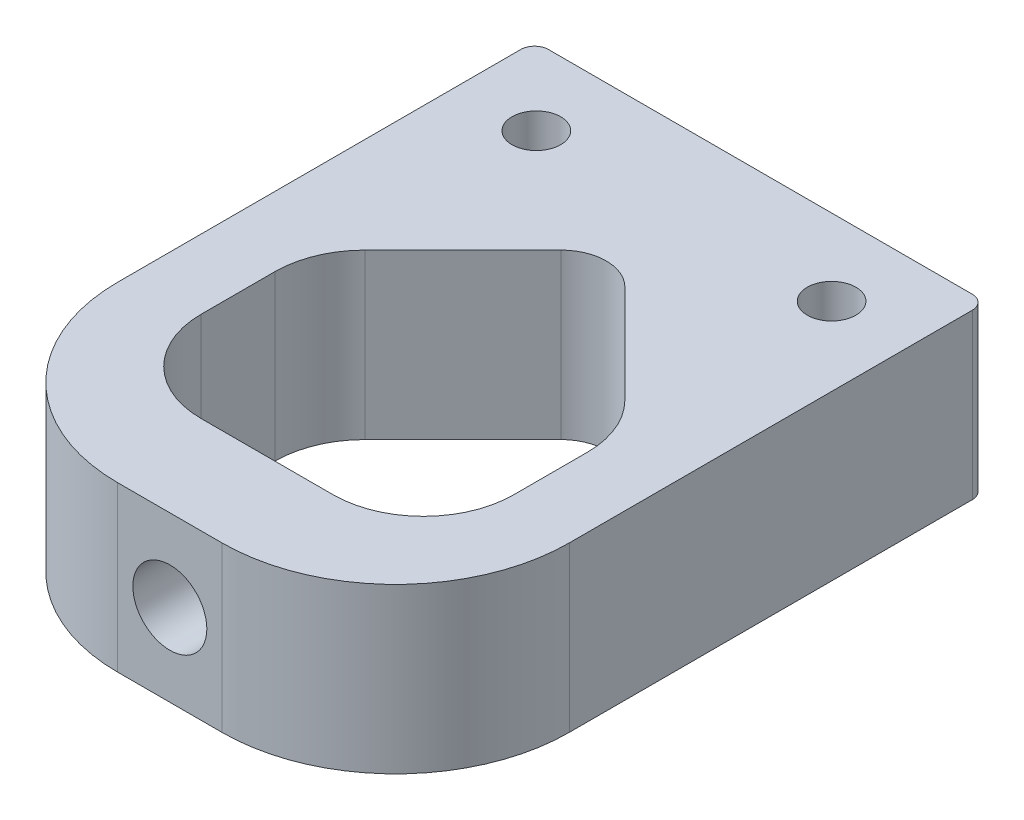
SolidWorks part; units mm, degrees
ref_plane "Front Plane" through (0, 0, 0) normal (0, 0, 1) x (1, 0, 0)
ref_plane "Top Plane" through (0, 0, 0) normal (0, 1, 0) x (1, 0, 0)
ref_plane "Right Plane" through (0, 0, 0) normal (1, 0, 0) x (0, 0, -1)
sketch "Sketch1" plane through (0, 0, 0) normal (0, 1, 0) x (1, 0, 0)
  line L1 (-27.0046, 23.0125) -> (-10.4946, 23.0125)
  line L2 (-27.0046, 23.0125) -> (-27.0046, 1.4225)
  line L3 (-27.0046, 1.4225) -> (-10.4946, 1.4225)
  line L4 (-10.4946, 23.0125) -> (-10.4946, 1.4225)
  dimension "D1" = 16.51
  dimension "D2" = 21.59
extrude "Boss-Extrude1" add sketch "Sketch1" along normal blind 6
sketch "Sketch2" plane through (0, 6, 0) normal (0, 1, 0) x (1, 0, 0)
  line L0 (-10.4946, 23.0125) -> (-27.0046, 23.0125) construction
  line L2 (-10.4946, 1.4225) -> (-10.4946, 23.0125) construction
  circle A0 centre (-24.1471, 20.2185) radius 0.7572
  circle A1 centre (-13.3521, 20.2185) radius 0.7572
  dimension "D1" = 10.795
  dimension "D2" = 2.794
  dimension "D4" = 2.8575
hole_wizard "#2-56 Tapped Hole1" positions "Sketch4" profile "Sketch3" tap size "#2-56" standard "ANSI Inch"
sketch "Sketch4" plane through (0, 6, 0) normal (0, 1, 0) x (1, 0, 0)
  point P0 (-24.1471, 20.2185)
  point P3 (-13.3521, 20.2185)
sketch "Sketch3" plane through (-24.1471, 6, -20.2185) normal (1, 0, 0) x (0, 0, 1)
  line L0 (0, 0) -> (0, 6)
  line L1 (0, 6) -> (0.889, 6)
  line L2 (0.889, 6) -> (0.889, 0)
  line L5 (0.889, 0) -> (0, 0)
  line L11 (0, -6.35) -> (0, 107.95) construction
  dimension "Thru Tap Drill Dia." = 1.778
  dimension "Thru Tap Drill Depth" = 6
sketch "Sketch5" plane through (0, 6, 0) normal (0, 1, 0) x (1, 0, 0)
  line L0 (-18.7496, 23.0125) -> (-18.7496, -5.13) construction
  line L1 (-10.4946, 23.0125) -> (-27.0046, 23.0125) construction
  line L2 (-18.7496, 18.0595) -> (-13.0346, 12.3445)
  line L4 (-24.4646, 12.3445) -> (-18.7496, 18.0595)
  line L5 (-24.4646, 4.9785) -> (-13.0346, 4.9785)
  line L6 (-24.4646, 4.9785) -> (-24.4646, 12.3445)
  line L7 (-18.7496, 4.9785) -> (-18.7496, 1.4225) construction
  line L8 (-27.0046, 23.0125) -> (-27.0046, 1.4225) construction
  line L10 (-13.0346, 4.9785) -> (-13.0346, 12.3445)
  line L13 (-27.0046, 18.0595) -> (-11.7646, 18.0595) construction
  line L14 (-27.0046, 1.4225) -> (-10.4946, 1.4225) construction
  circle A0 centre (-18.7496, 10.4395) radius 5.461 construction
  circle A1 centre (-18.7496, 11.0745) radius 4.7625 construction
  circle A2 centre (-18.7496, 16.1545) radius 1.651 construction
  dimension "D1" = 11.938
  dimension "D2" = 10.922
  dimension "D3" = 9.525
  dimension "D4" = 8.255
  dimension "D8" = 4.953
  dimension "D10" = 45
  dimension "D9" = 21.59
  dimension "D12" = 11.43
  dimension "D5" = 6.858
  dimension "D6" = 12.573
  dimension "D7" = 3.556
  dimension "D11" = 45
  dimension "D13" = 5.715
  dimension "D14" = 18.034
extrude "Cut-Extrude3" cut sketch "Sketch5" against normal through all
fillet "Fillet3" radius 0.508 2 edges at (-27.0046, 3, -23.0125) (-10.4946, 3, -23.0125)
fillet "Fillet1" radius 6.35 2 edges at (-27.0046, 3, -1.4225) (-10.4946, 3, -1.4225)
fillet "Fillet4" radius 3.302 4 edges at (-13.0346, 3, -4.9785) (-24.4646, 3, -4.9785) (-13.0346, 3, -12.3445) (-24.4646, 3, -12.3445)
fillet "Fillet5" radius 1.651 1 edges at (-18.7496, 3, -18.0595)
sketch "Sketch7" plane through (0, 0, -1.4225) normal (0, 0, 1) x (1, 0, 0)
  line L0 (-18.7496, 6) -> (-18.7496, 0) construction
  line L1 (-20.6546, 6) -> (-16.8446, 6) construction
  line L2 (-20.6546, 0) -> (-16.8446, 0) construction
  line L3 (-20.6546, 3) -> (-16.8446, 3) construction
  line L4 (-20.6546, 6) -> (-20.6546, 0) construction
  line L5 (-16.8446, 0) -> (-16.8446, 6) construction
  point P12 (-18.7496, 3)
hole_wizard "#6-32 Tapped Hole1" positions "Sketch11" profile "Sketch10" tap size "#6-32" standard "ANSI Inch"
sketch "Sketch11" plane through (0, 0, -1.4225) normal (0, 0, 1) x (1, 0, 0)
  point P0 (-18.7496, 3)
sketch "Sketch10" plane through (-18.7496, 3, -1.4225) normal (1, 0, 0) x (0, -1, 0)
  line L0 (0, 0) -> (0, 3.556)
  line L1 (0, 3.556) -> (1.3525, 3.556)
  line L2 (1.3525, 3.556) -> (1.3525, 0)
  line L5 (1.3525, 0) -> (0, 0)
  line L11 (0, -6.35) -> (0, 107.95) construction
  dimension "Thru Tap Drill Dia." = 2.7051
  dimension "Thru Tap Drill Depth" = 3.556
